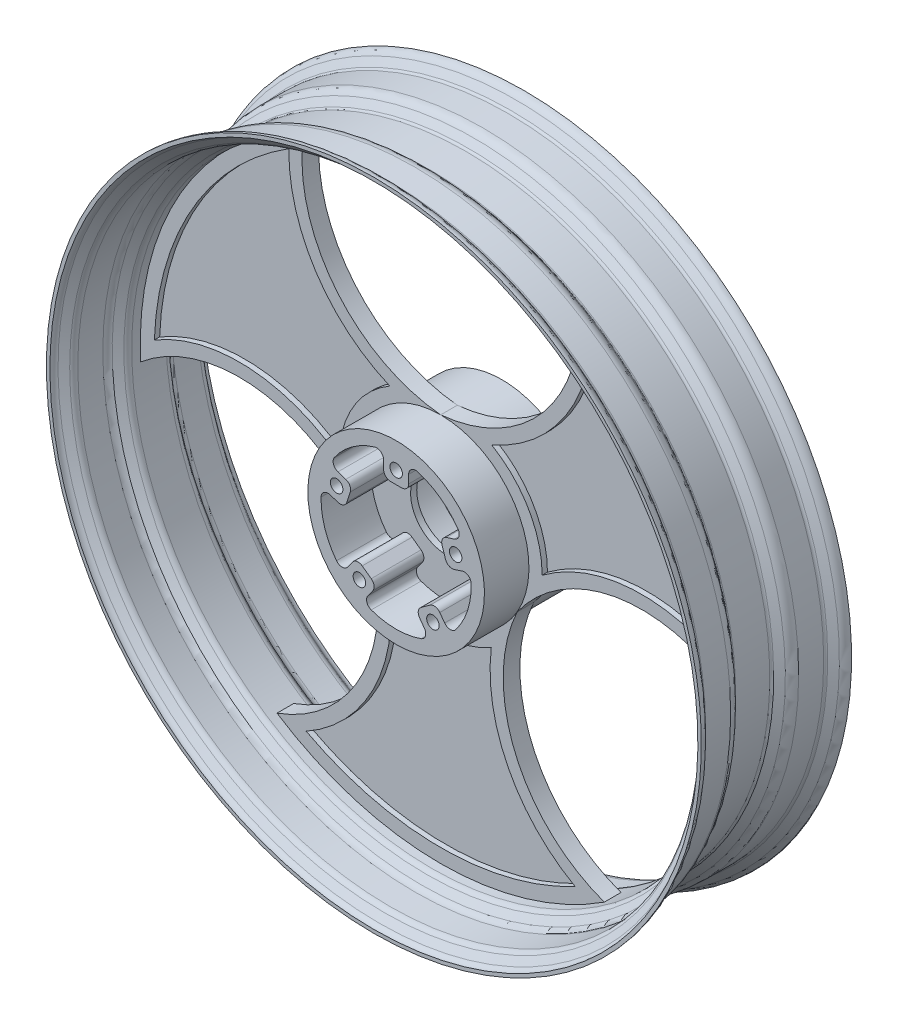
SolidWorks part; units mm, degrees
ref_plane "Front Plane" through (0, 0, 0) normal (0, 0, 1) x (1, 0, 0)
ref_plane "Top Plane" through (0, 0, 0) normal (0, 1, 0) x (1, 0, 0)
ref_plane "Right Plane" through (0, 0, 0) normal (1, 0, 0) x (0, 0, -1)
sketch "Sketch1" plane through (0, 0, 0) normal (1, 0, 0) x (0, 0, -1)
  line L0 (0, 50.9127) -> (0, -50.9127) construction
  line L1 (-50.9127, 0) -> (50.9127, 0) construction
  line L2 (-38, 0) -> (38, 0)
  line L3 (38, 0) -> (38, 63.5)
  line L4 (-38, 0) -> (-38, 63.5)
  line L5 (38, 63.5) -> (6, 63.5)
  line L6 (-38, 63.5) -> (-6, 63.5)
  line L7 (6, 63.5) -> (6, 216)
  line L8 (-6, 63.5) -> (-6, 216)
  line L9 (6, 216) -> (12.1905, 216)
  line L10 (-6, 216) -> (-12.1905, 216)
  line L11 (16.0208, 217.7861) -> (19.856, 222.3567)
  line L12 (-16.0208, 217.7861) -> (-19.856, 222.3567)
  line L13 (24.4523, 224.5) -> (42.4523, 224.5)
  line L14 (-24.4523, 224.5) -> (-42.4523, 224.5)
  line L15 (46.3803, 226.4063) -> (50.072, 231.0937)
  line L16 (-46.3803, 226.4063) -> (-50.072, 231.0937)
  line L17 (54, 233) -> (54, 235.5)
  line L18 (-54, 233) -> (-54, 235.5)
  line L19 (48.108, 232.6405) -> (44.4163, 227.9532)
  line L20 (-48.108, 232.6405) -> (-44.4163, 227.9532)
  line L21 (42.4523, 227) -> (24.4523, 227)
  line L22 (-42.4523, 227) -> (-24.4523, 227)
  line L23 (17.9409, 223.9637) -> (14.1057, 219.393)
  line L24 (-17.9409, 223.9637) -> (-14.1057, 219.393)
  line L25 (12.1905, 218.5) -> (-12.1905, 218.5)
  arc A0 (12.1905, 216) -> (16.0208, 217.7861) centre (12.1905, 221) ccw
  arc A1 (-12.1905, 216) -> (-16.0208, 217.7861) centre (-12.1905, 221) cw
  arc A2 (19.856, 222.3567) -> (24.4523, 224.5) centre (24.4523, 218.5) cw
  arc A3 (-19.856, 222.3567) -> (-24.4523, 224.5) centre (-24.4523, 218.5) ccw
  arc A4 (42.4523, 224.5) -> (46.3803, 226.4063) centre (42.4523, 229.5) ccw
  arc A5 (-42.4523, 224.5) -> (-46.3803, 226.4063) centre (-42.4523, 229.5) cw
  arc A6 (50.072, 231.0937) -> (54, 233) centre (54, 228) cw
  arc A7 (-50.072, 231.0937) -> (-54, 233) centre (-54, 228) ccw
  arc A8 (54, 235.5) -> (48.108, 232.6405) centre (54, 228) ccw
  arc A9 (-54, 235.5) -> (-48.108, 232.6405) centre (-54, 228) cw
  arc A10 (44.4163, 227.9532) -> (42.4523, 227) centre (42.4523, 229.5) cw
  arc A11 (-44.4163, 227.9532) -> (-42.4523, 227) centre (-42.4523, 229.5) ccw
  arc A12 (24.4523, 227) -> (17.9409, 223.9637) centre (24.4523, 218.5) ccw
  arc A13 (-24.4523, 227) -> (-17.9409, 223.9637) centre (-24.4523, 218.5) cw
  arc A14 (14.1057, 219.393) -> (12.1905, 218.5) centre (12.1905, 221) cw
  arc A15 (-14.1057, 219.393) -> (-12.1905, 218.5) centre (-12.1905, 221) ccw
  point P9 (0, 0)
  point P61 (0, 218.5)
  dimension "D3" = 5
  dimension "D1" = 2.5
  dimension "D2" = 50
  dimension "D4" = 54
  dimension "D5" = 18
  dimension "D6" = 8.5
  dimension "D7" = 8.5
  dimension "D8" = 32
  dimension "D9" = 63.5
  dimension "D10" = 76
  dimension "D11" = 432
revolve "Revolve1" add sketch "Sketch1" angle 360 about L1
sketch "Sketch2" plane through (0, 0, 6) normal (0, 0, 1) x (1, 0, 0)
  line L0 (0, 0) -> (0, 254.0596) construction
  arc A0 (0, 63.5) -> (98, 192.489) centre (-10.2634, 173.0201) ccw
  arc A1 (0, 63.5) -> (-98, 192.489) centre (10.2634, 173.0201) cw
  circle A7 centre (0, 0) radius 63.5 construction
  circle A8 centre (0, 0) radius 216 construction
  circle A10 centre (0, 0) radius 216 construction
  arc A11 (-98, 192.489) -> (98, 192.489) centre (0, 0) cw
  dimension "D1" = 110
  dimension "D2" = 196
extrude "Cut-Extrude1" cut sketch "Sketch2" against normal up to next
pattern_circular "CirPattern1" count 3 over 360 about axis through (0, 0, 0) along (0, 0, 1) of "Cut-Extrude1"
sketch "Sketch4" plane through (0, 0, 6) normal (0, 0, 1) x (1, 0, 0)
  line L0 (0, 0) -> (-235.5281, 135.9822) construction
  line L1 (0, 0) -> (0, 259.2316) construction
  arc A0 (-205.8745, 7.1893) -> (-72.9999, 0.1186) centre (-144.7081, -95.3984) cw
  arc A1 (-36.6026, 63.1605) -> (-109.1634, 174.6979) centre (10.2634, 173.0201) cw
  arc A2 (-36.6026, 63.1605) -> (-72.9999, 0.1186) centre (0, 0) ccw
  arc A3 (-109.1634, 174.6979) -> (-205.8745, 7.1893) centre (0, 0) ccw
  circle A16 centre (0, 0) radius 63.5 construction
  arc A17 (-54.9926, -31.75) -> (-215.7003, -11.374) centre (-144.7081, -95.3984) ccw construction
  arc A19 (-98, 192.489) -> (0, 63.5) centre (10.2634, 173.0201) ccw construction
  dimension "D3" = 56
  dimension "D4" = 206
  dimension "D2" = 73
  dimension "D1" = 60
extrude "Cut-Extrude2" cut sketch "Sketch4" against normal blind 3.81
pattern_circular "CirPattern2" count 3 over 360 about axis through (0, 0, 0) along (0, 0, 1) of "Cut-Extrude2"
mirror "Mirror1" about plane through (0, 0, 0) normal (0, 0, 1) of "CirPattern2", "Cut-Extrude2"
sketch "Sketch5" plane through (0, 0, 38) normal (0, 0, 1) x (1, 0, 0)
  circle A0 centre (0, 0) radius 54
  dimension "D1" = 108
extrude "Cut-Extrude3" cut sketch "Sketch5" against normal up to surface (35.81 mm away)
mirror "Mirror4" about plane through (0, 0, 0) normal (0, 0, 1) of "Cut-Extrude3"
sketch "Sketch7" plane through (0, 0, 2.19) normal (0, 0, 1) x (1, 0, 0)
  circle A0 centre (0, 0) radius 25.4
  dimension "D1" = 50.8
extrude "Cut-Extrude4" cut sketch "Sketch7" against normal up to next
sketch "Sketch8" plane through (0, 0, 38) normal (0, 0, 1) x (1, 0, 0)
  line L0 (0, 0) -> (0, 76.2199) construction
  line L3 (-9, 53.2447) -> (-9, 36)
  line L4 (-9, 36) -> (9, 36)
  line L5 (9, 53.2447) -> (9, 36)
  circle A0 centre (0, 0) radius 54 construction
  arc A1 (9, 53.2447) -> (-9, 53.2447) centre (0, 0) ccw
  dimension "D1" = 18
  dimension "D2" = 36
extrude "Boss-Extrude2" add sketch "Sketch8" against normal up to next
sketch "Sketch9" plane through (0, 0, 38) normal (0, 0, 1) x (1, 0, 0)
  circle A0 centre (0, 45) radius 4.5
  dimension "D1" = 9
  dimension "D2" = 45
extrude "Cut-Extrude5" cut sketch "Sketch9" against normal blind 25.4
pattern_circular "CirPattern3" count 5 over 360 about axis through (0, 0, 0) along (0, 0, 1) of "Boss-Extrude2", "Cut-Extrude5"
fillet "Fillet1" radius 5 20 edges at (-38.5776, -37.7858, 20.095) (-28.4414, -23.8345, 20.095) (-24.0153, -48.3659, 20.095) (-13.8791, -34.4147, 20.095) (24.0153, -48.3659, 20.095) (13.8791, -34.4147, 20.095) (38.5776, -37.7858, 20.095) (28.4414, -23.8345, 20.095) (47.8576, 25.013, 20.095) (53.4199, 7.894, 20.095) (31.4569, 19.6841, 20.095) (37.0192, 2.5651, 20.095) (-9, 53.2447, 20.095) (9, 53.2447, 20.095) (9, 36, 20.095) (-9, 36, 20.095) (-53.4199, 7.894, 20.095) (-47.8576, 25.013, 20.095) (-31.4569, 19.6841, 20.095) (-37.0192, 2.5651, 20.095)
